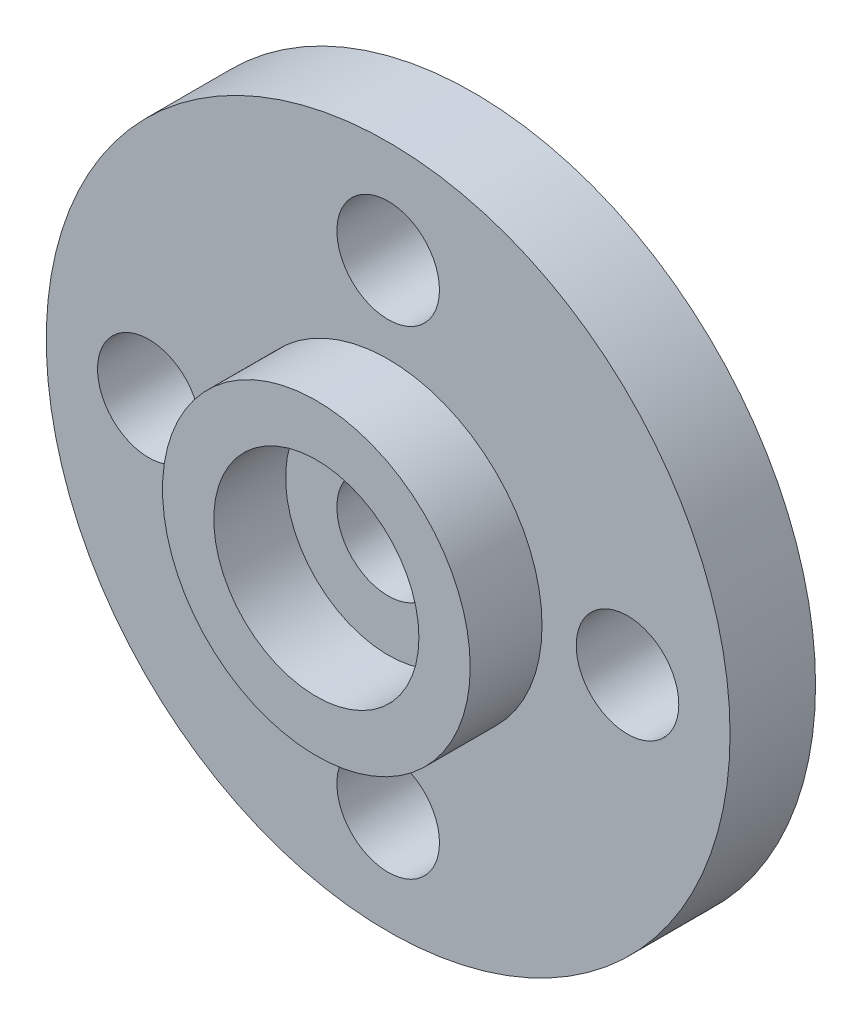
SolidWorks part; units mm, degrees
ref_plane "前视基准面" through (0, 0, 0) normal (0, 0, 1) x (1, 0, 0)
ref_plane "上视基准面" through (0, 0, 0) normal (0, 1, 0) x (1, 0, 0)
ref_plane "右视基准面" through (0, 0, 0) normal (1, 0, 0) x (0, 0, -1)
other "Configuration Table"
sketch "草图1" plane through (0, 0, 0) normal (0, 0, 1) x (1, 0, 0)
  circle A0 centre (0, 0) radius 10
  dimension "D1" = 20
extrude "凸台-拉伸1" add sketch "草图1" along normal blind 2.5
sketch "草图2" plane through (0, 0, 2.5) normal (0, 0, 1) x (1, 0, 0)
  circle A0 centre (0, 0) radius 4.5
  circle A1 centre (0, 0) radius 3
  dimension "D1" = 9
  dimension "D2" = 6
extrude "凸台-拉伸2" add sketch "草图2" along normal blind 2.1
sketch "草图3" plane through (0, 0, 2.5) normal (0, 0, 1) x (1, 0, 0)
  circle A0 centre (0, 0) radius 1.5
  dimension "D1" = 3
extrude "切除-拉伸1" cut sketch "草图3" against normal blind 3
sketch "草图4" plane through (0, 0, 2.5) normal (0, 0, 1) x (1, 0, 0)
  circle A0 centre (0, 0) radius 7 construction
  circle A1 centre (0, 7) radius 1.5
  circle A2 centre (7, 0) radius 1.5
  circle A3 centre (0, -7) radius 1.5
  circle A4 centre (-7, 0) radius 1.5
  point P14 (0, 0)
  dimension "D1" = 14
  dimension "D2" = 3
  dimension "D3" = 4
extrude "切除-拉伸2" cut sketch "草图4" against normal blind 3
